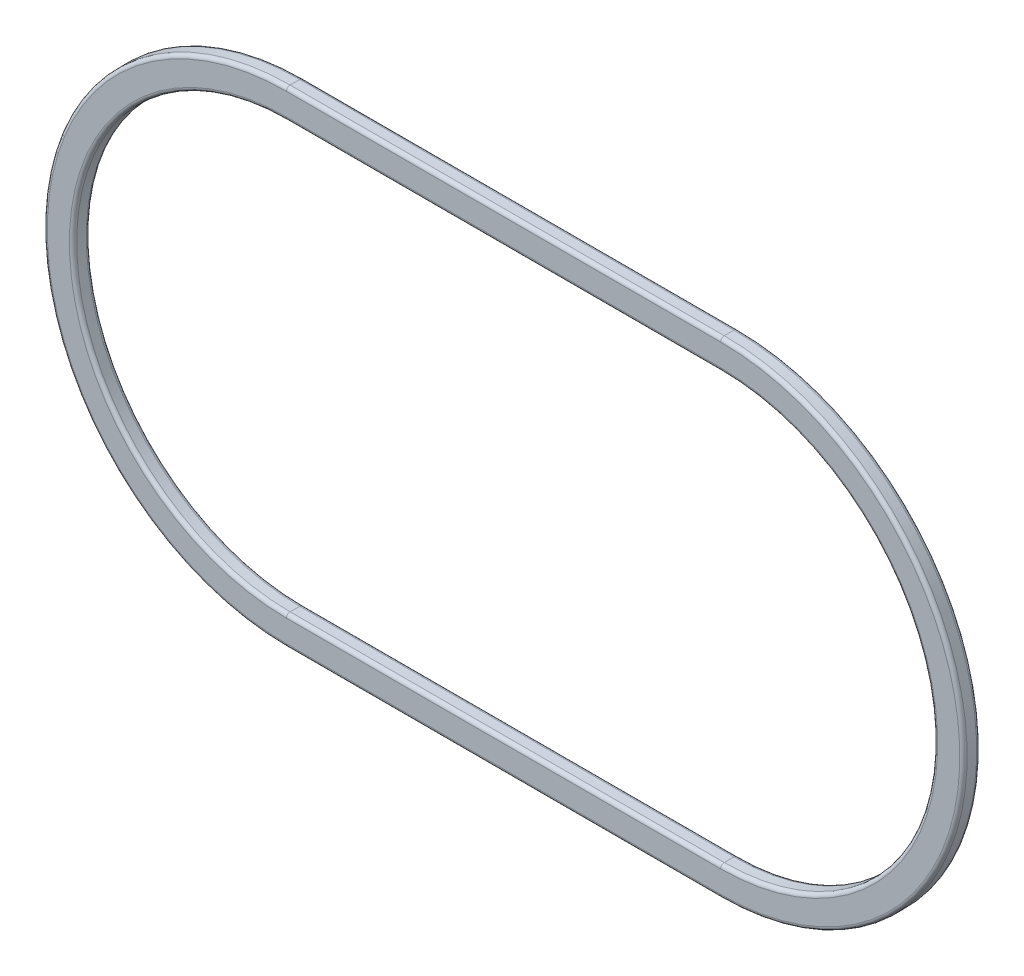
SolidWorks part; units mm, degrees
ref_plane "Plan de face" through (0, 0, 0) normal (0, 0, 1) x (1, 0, 0)
ref_plane "Plan de dessus" through (0, 0, 0) normal (0, 1, 0) x (1, 0, 0)
ref_plane "Plan de droite" through (0, 0, 0) normal (1, 0, 0) x (0, 0, -1)
sketch "Esquisse1" plane through (0, 0, 0) normal (0, 0, 1) x (1, 0, 0)
  line L0 (0, 0) -> (59, 0) construction
  line L1 (0, 33) -> (59, 33)
  line L2 (0, -33) -> (59, -33)
  line L3 (0, -36.3) -> (0, 36.3) construction
  arc A0 (0, 33) -> (0, -33) centre (0, 0) ccw
  arc A1 (59, -33) -> (59, 33) centre (59, 0) ccw
  point P3 (29.5, 0)
  dimension "D1" = 59
  dimension "D3" = 59
  dimension "D2" = 66
sketch "Esquisse2" plane through (0, 0, 0) normal (1, 0, 0) x (0, 0, -1)
  line L1 (-3.2835, 29) -> (-1.9835, 29)
  line L2 (-3.7835, 29.5) -> (-3.7835, 32.5)
  line L3 (-3.2835, 33) -> (-1.9835, 33)
  line L4 (-1.4835, 29.5) -> (-1.4835, 32.5)
  arc A0 (-1.4835, 32.5) -> (-1.9835, 33) centre (-1.9835, 32.5) ccw
  arc A1 (-1.4835, 29.5) -> (-1.9835, 29) centre (-1.9835, 29.5) cw
  arc A2 (-3.2835, 29) -> (-3.7835, 29.5) centre (-3.2835, 29.5) cw
  arc A3 (-3.7835, 32.5) -> (-3.2835, 33) centre (-3.2835, 32.5) cw
  dimension "D4" = 0.5
  dimension "D1" = 33
  dimension "D2" = 2.3
  dimension "D3" = 29
sweep "Balayage1" add profiles "Esquisse2" path "Esquisse1"
